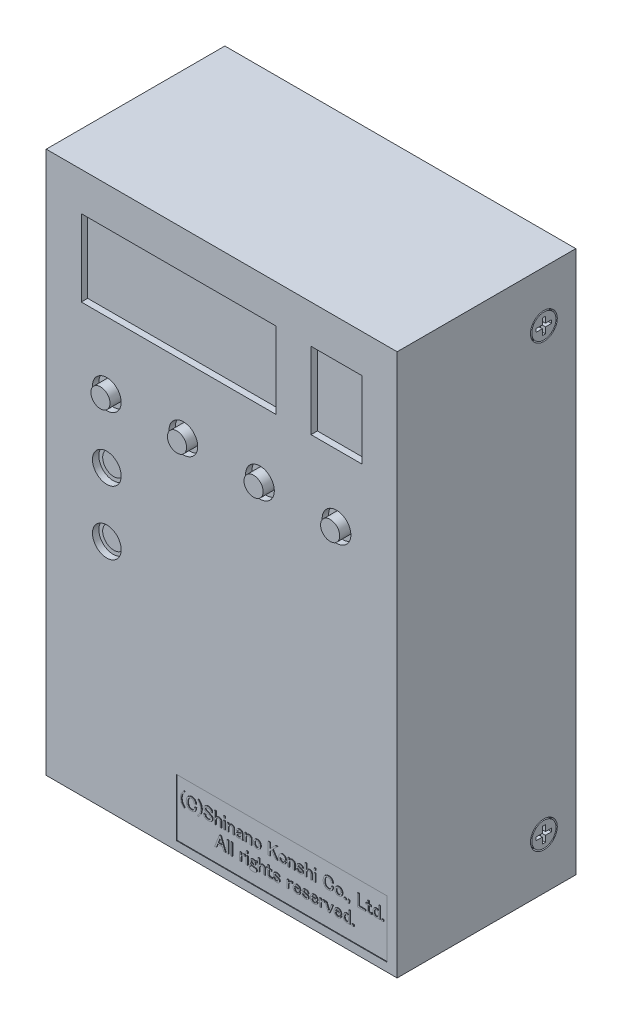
SolidWorks part; units mm, degrees
ref_plane "Front" through (0, 0, 0) normal (0, 0, 1) x (1, 0, 0)
ref_plane "Top" through (0, 0, 0) normal (0, 1, 0) x (1, 0, 0)
ref_plane "Right" through (0, 0, 0) normal (1, 0, 0) x (0, 0, -1)
ref_plane "Plane1" through (0, 0, 12.1) normal (0, 0, -1) x (-1, 0, 0)
sketch "Sketch1" plane through (0, 0, 12.1) normal (0, 0, -1) x (-1, 0, 0)
  line L0 (24.5, -30.5) -> (-24.5, -30.5)
  line L1 (-24.5, -30.5) -> (-24.5, -42.5)
  line L2 (-24.5, -42.5) -> (24.5, -42.5)
  line L3 (24.5, -42.5) -> (24.5, -30.5)
extrude "Extrude1" add sketch "Sketch1" against normal blind 1.5
imported_body "Imported3"
imported_body "Imported4"
imported_body "Imported5"
imported_body "Imported6"
imported_body "Imported7"
imported_body "Imported8"
imported_body "Imported9"
imported_body "Imported10"
imported_body "Imported11"
imported_body "Imported12"
